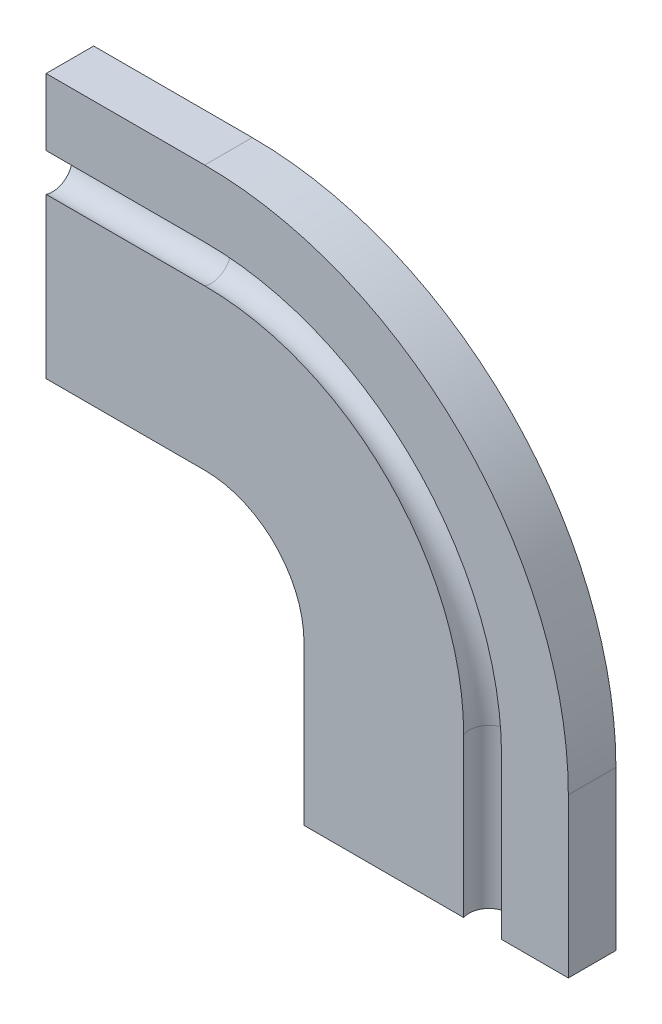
SolidWorks part; units mm, degrees
ref_plane "Front Plane" through (0, 0, 0) normal (0, 0, 1) x (1, 0, 0)
ref_plane "Top Plane" through (0, 0, 0) normal (0, 1, 0) x (1, 0, 0)
ref_plane "Right Plane" through (0, 0, 0) normal (1, 0, 0) x (0, 0, -1)
sketch "Sketch1" plane through (0, 0, 0) normal (0, 0, 1) x (1, 0, 0)
  line L0 (0, 0) -> (50, 0) construction
  line L1 (50, 0) -> (50, 30) construction
  line L2 (-20, 100) -> (-50, 100) construction
  line L3 (-50, 100) -> (-50, 50) construction
  line L4 (-50, 50) -> (-20, 50)
  line L5 (0, 30) -> (0, 0)
  arc A0 (50, 30) -> (-20, 100) centre (-20, 30) ccw construction
  arc A1 (-20, 50) -> (0, 30) centre (-20, 30) cw
  dimension "D3" = 20
  dimension "D1" = 50
  dimension "D2" = 30
sketch "Sketch2" plane through (0, 0, 0) normal (0, 1, 0) x (1, 0, 0)
  line L0 (-1.214, -1.214) -> (28.9859, -1.214)
  line L1 (0, 0) -> (50, 0) construction
  line L4 (36.1581, -1.214) -> (48.786, -1.214)
  line L5 (48.786, -1.214) -> (48.786, 7.786)
  line L6 (48.786, 7.786) -> (47.572, 7.786)
  line L7 (47.572, 7.786) -> (47.572, 0)
  line L8 (47.572, 0) -> (37.572, 0)
  line L9 (27.572, 0) -> (0, 0)
  line L10 (0, 0) -> (0, 7.786)
  line L11 (0, 7.786) -> (-1.214, 7.786)
  line L12 (-1.214, 7.786) -> (-1.214, -1.214)
  arc A0 (28.9859, -1.214) -> (36.1581, -1.214) centre (32.572, 0) cw
  arc A1 (27.572, 0) -> (37.572, 0) centre (32.572, 0) cw
  dimension "D5" = 5
  dimension "D6" = 1.214
  dimension "D1" = 9
  dimension "D2" = 1.214
  dimension "D3" = 50
  dimension "D4" = 1.214
  dimension "D7" = 15
sweep "Sweep1" add profiles "Sketch2" path "Sketch1"
